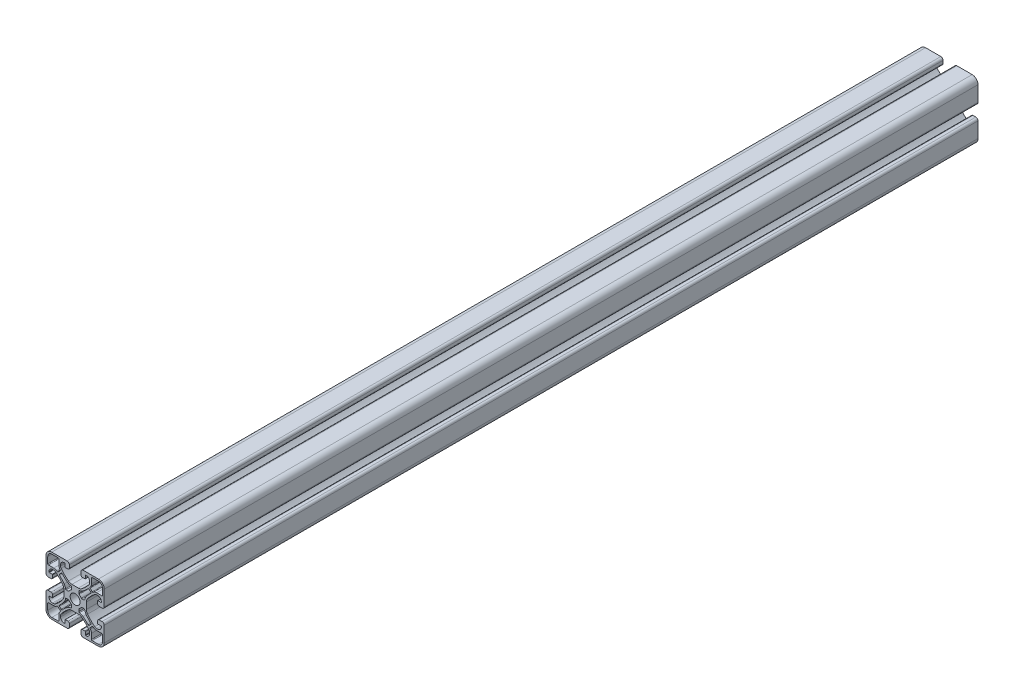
SolidWorks part; units mm, degrees
ref_plane "Face" through (0, 0, 0) normal (0, 0, 1) x (1, 0, 0)
ref_plane "Dessus" through (0, 0, 0) normal (0, 1, 0) x (1, 0, 0)
ref_plane "Droite" through (0, 0, 0) normal (1, 0, 0) x (0, 0, -1)
sketch "Esquisse profilé" plane through (0, 0, 0) normal (0, 0, 1) x (1, 0, 0)
  line L0 (11.6997, 18.8) -> (16, 18.8)
  line L1 (18.8, 16) -> (18.8, 11.7)
  line L2 (18.3, 11.2) -> (14.67, 11.2)
  line L3 (12.3957, 10.2874) -> (12.7389, 10.5517)
  line L4 (11.7339, 10.3275) -> (10.3272, 11.7342)
  line L5 (10.5513, 12.7393) -> (10.2871, 12.3961)
  line L6 (11.1997, 14.6704) -> (11.1997, 18.3)
  line L7 (-11.1997, 14.6699) -> (-11.1997, 18.3)
  line L8 (-10.5517, 12.7393) -> (-10.2874, 12.3961)
  line L9 (-11.7342, 10.3275) -> (-10.3275, 11.7342)
  line L10 (-12.3961, 10.2874) -> (-12.7393, 10.5517)
  line L11 (-18.3, 11.2) -> (-14.6704, 11.2)
  line L12 (-18.8, 16) -> (-18.8, 11.7)
  line L13 (-11.6997, 18.8) -> (-16, 18.8)
  line L14 (-2.5, 6.0982) -> (-2.5, 4.6098)
  line L15 (-4.6098, 2.5) -> (-6.0982, 2.5)
  line L16 (-10.7615, 9.6032) -> (-9.6032, 10.7615)
  line L17 (-10.7615, -9.6032) -> (-9.6032, -10.7615)
  line L18 (-4.6098, -2.5) -> (-6.0982, -2.5)
  line L19 (-2.5, -6.0982) -> (-2.5, -4.6098)
  line L20 (-11.7, -18.8) -> (-16, -18.8)
  line L21 (-18.8, -16) -> (-18.8, -11.7)
  line L22 (-18.3, -11.2) -> (-14.6704, -11.2)
  line L23 (-12.3961, -10.2874) -> (-12.7393, -10.5517)
  line L24 (-11.7342, -10.3275) -> (-10.3275, -11.7342)
  line L25 (-10.5517, -12.7393) -> (-10.2874, -12.3961)
  line L26 (-11.2, -14.6704) -> (-11.2, -18.3)
  line L27 (9.6032, 10.7615) -> (10.7615, 9.6032)
  line L28 (6.0982, 2.5) -> (4.6098, 2.5)
  line L29 (2.5, 4.6098) -> (2.5, 6.0982)
  line L30 (2.5, -4.6098) -> (2.5, -6.0982)
  line L31 (6.0982, -2.5) -> (4.6098, -2.5)
  line L32 (9.6032, -10.7615) -> (10.7615, -9.6032)
  line L33 (11.1997, -14.6704) -> (11.1997, -18.3)
  line L34 (10.5513, -12.7393) -> (10.2871, -12.3961)
  line L35 (11.7339, -10.3275) -> (10.3272, -11.7342)
  line L36 (12.3957, -10.2874) -> (12.7389, -10.5517)
  line L37 (18.3, -11.2) -> (14.67, -11.2)
  line L38 (18.8, -16) -> (18.8, -11.7)
  line L39 (11.6997, -18.8) -> (16, -18.8)
  line L40 (5.5, -20) -> (16, -20)
  line L41 (4, -16.5) -> (4, -18.5)
  line L42 (6.75, -15.5) -> (5, -15.5)
  line L43 (7, -17.75) -> (7, -15.75)
  line L44 (7.5, -18) -> (7.25, -18)
  line L45 (10, -14.7204) -> (10, -15.5)
  line L46 (-2.1931, -7.75) -> (2.1931, -7.75)
  line L47 (-10, -15.5) -> (-10, -14.7204)
  line L48 (-7.25, -18) -> (-7.5, -18)
  line L49 (-7, -15.75) -> (-7, -17.75)
  line L50 (-5, -15.5) -> (-6.75, -15.5)
  line L51 (-4, -18.5) -> (-4, -16.5)
  line L52 (-16, -20) -> (-5.5, -20)
  line L53 (-20, -5.5) -> (-20, -16)
  line L54 (-16.5, -4) -> (-18.5, -4)
  line L55 (-15.5, -6.75) -> (-15.5, -5)
  line L56 (-17.75, -7) -> (-15.75, -7)
  line L57 (-18, -7.5) -> (-18, -7.25)
  line L58 (-14.7204, -10) -> (-15.5, -10)
  line L59 (-7.75, 2.1931) -> (-7.75, -2.1931)
  line L60 (-15.5, 10) -> (-14.7204, 10)
  line L61 (-18, 7.25) -> (-18, 7.5)
  line L62 (-15.75, 7) -> (-17.75, 7)
  line L63 (-15.5, 5) -> (-15.5, 6.75)
  line L64 (-18.5, 4) -> (-16.5, 4)
  line L65 (-20, 16) -> (-20, 5.5)
  line L66 (-5.5, 20) -> (-16, 20)
  line L67 (-4, 16.5) -> (-4, 18.5)
  line L68 (-6.75, 15.5) -> (-5, 15.5)
  line L69 (-7, 17.75) -> (-7, 15.75)
  line L70 (-7.5, 18) -> (-7.25, 18)
  line L71 (-10, 14.7204) -> (-10, 15.5)
  line L72 (2.1931, 7.75) -> (-2.1931, 7.75)
  line L73 (10, 15.5) -> (10, 14.7204)
  line L74 (7.25, 18) -> (7.5, 18)
  line L75 (7, 15.75) -> (7, 17.75)
  line L76 (5, 15.5) -> (6.75, 15.5)
  line L77 (4, 18.5) -> (4, 16.5)
  line L78 (16, 20) -> (5.5, 20)
  line L79 (20, 5.5) -> (20, 16)
  line L80 (16.5, 4) -> (18.5, 4)
  line L81 (15.5, 6.75) -> (15.5, 5)
  line L82 (17.75, 7) -> (15.75, 7)
  line L83 (18, 7.5) -> (18, 7.25)
  line L84 (14.7204, 10) -> (15.5, 10)
  line L85 (7.75, -2.1931) -> (7.75, 2.1931)
  line L86 (15.5, -10) -> (14.7204, -10)
  line L87 (18, -7.25) -> (18, -7.5)
  line L88 (15.75, -7) -> (17.75, -7)
  line L89 (15.5, -5) -> (15.5, -6.75)
  line L90 (18.5, -4) -> (16.5, -4)
  line L91 (20, -16) -> (20, -5.5)
  arc A0 (11.1997, 18.3) -> (11.6997, 18.8) centre (11.6997, 18.3) cw
  arc A1 (-11.1997, 14.6699) -> (-10.5517, 12.7393) centre (-7.9997, 14.6699) ccw
  arc A2 (16, 18.8) -> (18.8, 16) centre (16, 16) cw
  arc A3 (18.8, 11.7) -> (18.3, 11.2) centre (18.3, 11.7) cw
  arc A4 (12.7389, 10.5517) -> (14.67, 11.2) centre (14.67, 8) cw
  arc A5 (12.3957, 10.2874) -> (11.7339, 10.3275) centre (12.0874, 10.6811) cw
  arc A6 (10.3272, 11.7342) -> (10.2871, 12.3961) centre (10.6807, 12.0878) cw
  arc A7 (11.1997, 14.6704) -> (10.5513, 12.7393) centre (7.9997, 14.6704) cw
  arc A8 (-10.3275, 11.7342) -> (-10.2874, 12.3961) centre (-10.6811, 12.0878) ccw
  arc A9 (-12.3961, 10.2874) -> (-11.7342, 10.3275) centre (-12.0878, 10.6811) ccw
  arc A10 (-12.7393, 10.5517) -> (-14.6704, 11.2) centre (-14.6704, 8) ccw
  arc A11 (-18.8, 11.7) -> (-18.3, 11.2) centre (-18.3, 11.7) ccw
  arc A12 (-16, 18.8) -> (-18.8, 16) centre (-16, 16) ccw
  arc A13 (-11.1997, 18.3) -> (-11.6997, 18.8) centre (-11.6997, 18.3) ccw
  arc A14 (-8.8828, 10.7477) -> (-5.38, 7.59) centre (10.34, 28.55) ccw
  arc A15 (-5.38, 7.59) -> (-2.9351, 6.594) centre (-2.26, 11.75) ccw
  arc A16 (-2.5, 6.0982) -> (-2.9351, 6.594) centre (-3, 6.0982) ccw
  arc A17 (-2.7273, 4.1907) -> (-2.5, 4.6098) centre (-3, 4.6098) ccw
  arc A18 (-2.7273, 4.1907) -> (-4.1907, 2.7273) centre (0, 0) ccw
  arc A19 (-4.6098, 2.5) -> (-4.1907, 2.7273) centre (-4.6098, 3) ccw
  arc A20 (-6.594, 2.9351) -> (-6.0982, 2.5) centre (-6.0982, 3) ccw
  arc A21 (-6.594, 2.9351) -> (-7.59, 5.38) centre (-11.75, 2.26) ccw
  arc A22 (-7.59, 5.38) -> (-10.7477, 8.8828) centre (-28.55, -10.34) ccw
  arc A23 (-10.7615, 9.6032) -> (-10.7477, 8.8828) centre (-10.4079, 9.2497) ccw
  arc A24 (-8.8828, 10.7477) -> (-9.6032, 10.7615) centre (-9.2497, 10.4079) ccw
  arc A25 (-8.8828, -10.7477) -> (-9.6032, -10.7615) centre (-9.2497, -10.4079) cw
  arc A26 (-10.7615, -9.6032) -> (-10.7477, -8.8828) centre (-10.4079, -9.2497) cw
  arc A27 (-7.59, -5.38) -> (-10.7477, -8.8828) centre (-28.55, 10.34) cw
  arc A28 (-6.594, -2.9351) -> (-7.59, -5.38) centre (-11.75, -2.26) cw
  arc A29 (-6.594, -2.9351) -> (-6.0982, -2.5) centre (-6.0982, -3) cw
  arc A30 (-4.6098, -2.5) -> (-4.1907, -2.7273) centre (-4.6098, -3) cw
  arc A31 (-2.7273, -4.1907) -> (-4.1907, -2.7273) centre (0, 0) cw
  arc A32 (-2.7273, -4.1907) -> (-2.5, -4.6098) centre (-3, -4.6098) cw
  arc A33 (-2.5, -6.0982) -> (-2.9351, -6.594) centre (-3, -6.0982) cw
  arc A34 (-5.38, -7.59) -> (-2.9351, -6.594) centre (-2.26, -11.75) cw
  arc A35 (-8.8828, -10.7477) -> (-5.38, -7.59) centre (10.34, -28.55) cw
  arc A36 (-11.2, -18.3) -> (-11.7, -18.8) centre (-11.7, -18.3) cw
  arc A37 (-16, -18.8) -> (-18.8, -16) centre (-16, -16) cw
  arc A38 (-18.8, -11.7) -> (-18.3, -11.2) centre (-18.3, -11.7) cw
  arc A39 (-12.7393, -10.5517) -> (-14.6704, -11.2) centre (-14.6704, -8) cw
  arc A40 (-12.3961, -10.2874) -> (-11.7342, -10.3275) centre (-12.0878, -10.6811) cw
  arc A41 (-10.3275, -11.7342) -> (-10.2874, -12.3961) centre (-10.6811, -12.0878) cw
  arc A42 (-11.2, -14.6704) -> (-10.5517, -12.7393) centre (-8, -14.6704) cw
  arc A43 (10.7477, 8.8828) -> (10.7615, 9.6032) centre (10.4079, 9.2497) ccw
  arc A44 (10.7477, 8.8828) -> (7.59, 5.38) centre (28.55, -10.34) ccw
  arc A45 (7.59, 5.38) -> (6.594, 2.9351) centre (11.75, 2.26) ccw
  arc A46 (6.0982, 2.5) -> (6.594, 2.9351) centre (6.0982, 3) ccw
  arc A47 (4.1907, 2.7273) -> (4.6098, 2.5) centre (4.6098, 3) ccw
  arc A48 (4.1907, 2.7273) -> (2.7273, 4.1907) centre (0, 0) ccw
  arc A49 (2.5, 4.6098) -> (2.7273, 4.1907) centre (3, 4.6098) ccw
  arc A50 (2.9351, 6.594) -> (2.5, 6.0982) centre (3, 6.0982) ccw
  arc A51 (2.9351, 6.594) -> (5.38, 7.59) centre (2.26, 11.75) ccw
  arc A52 (5.38, 7.59) -> (8.8828, 10.7477) centre (-10.34, 28.55) ccw
  arc A53 (9.6032, 10.7615) -> (8.8828, 10.7477) centre (9.2497, 10.4079) ccw
  arc A54 (9.6032, -10.7615) -> (8.8828, -10.7477) centre (9.2497, -10.4079) cw
  arc A55 (5.38, -7.59) -> (8.8828, -10.7477) centre (-10.34, -28.55) cw
  arc A56 (2.9351, -6.594) -> (5.38, -7.59) centre (2.26, -11.75) cw
  arc A57 (2.9351, -6.594) -> (2.5, -6.0982) centre (3, -6.0982) cw
  arc A58 (2.5, -4.6098) -> (2.7273, -4.1907) centre (3, -4.6098) cw
  arc A59 (4.1907, -2.7273) -> (2.7273, -4.1907) centre (0, 0) cw
  arc A60 (4.1907, -2.7273) -> (4.6098, -2.5) centre (4.6098, -3) cw
  arc A61 (6.0982, -2.5) -> (6.594, -2.9351) centre (6.0982, -3) cw
  arc A62 (7.59, -5.38) -> (6.594, -2.9351) centre (11.75, -2.26) cw
  arc A63 (10.7477, -8.8828) -> (7.59, -5.38) centre (28.55, 10.34) cw
  arc A64 (10.7477, -8.8828) -> (10.7615, -9.6032) centre (10.4079, -9.2497) cw
  arc A65 (11.1997, -14.6704) -> (10.5513, -12.7393) centre (7.9997, -14.6704) ccw
  arc A66 (10.3272, -11.7342) -> (10.2871, -12.3961) centre (10.6807, -12.0878) ccw
  arc A67 (12.3957, -10.2874) -> (11.7339, -10.3275) centre (12.0874, -10.6811) ccw
  arc A68 (12.7389, -10.5517) -> (14.67, -11.2) centre (14.67, -8) ccw
  arc A69 (18.8, -11.7) -> (18.3, -11.2) centre (18.3, -11.7) ccw
  arc A70 (16, -18.8) -> (18.8, -16) centre (16, -16) ccw
  arc A71 (11.1997, -18.3) -> (11.6997, -18.8) centre (11.6997, -18.3) ccw
  circle A72 centre (0, 0) radius 3.4
  arc A73 (16, -20) -> (20, -16) centre (16, -16) ccw
  arc A74 (4, -18.5) -> (5.5, -20) centre (5.5, -18.5) ccw
  arc A75 (5, -15.5) -> (4, -16.5) centre (5, -16.5) ccw
  arc A76 (7, -15.75) -> (6.75, -15.5) centre (6.75, -15.75) ccw
  arc A77 (7, -17.75) -> (7.25, -18) centre (7.25, -17.75) ccw
  arc A78 (7.5, -18) -> (10, -15.5) centre (7.5, -15.5) ccw
  arc A79 (10, -14.7204) -> (9.5948, -13.5134) centre (8, -14.7204) ccw
  arc A80 (9.5948, -13.5134) -> (4.5803, -8.5405) centre (-10.34, -28.6) ccw
  arc A81 (4.5803, -8.5405) -> (2.1931, -7.75) centre (2.1931, -11.75) ccw
  arc A82 (-2.1931, -7.75) -> (-4.5803, -8.5405) centre (-2.1931, -11.75) ccw
  arc A83 (-4.5803, -8.5405) -> (-9.5948, -13.5134) centre (10.34, -28.6) ccw
  arc A84 (-9.5948, -13.5134) -> (-10, -14.7204) centre (-8, -14.7204) ccw
  arc A85 (-10, -15.5) -> (-7.5, -18) centre (-7.5, -15.5) ccw
  arc A86 (-7.25, -18) -> (-7, -17.75) centre (-7.25, -17.75) ccw
  arc A87 (-6.75, -15.5) -> (-7, -15.75) centre (-6.75, -15.75) ccw
  arc A88 (-4, -16.5) -> (-5, -15.5) centre (-5, -16.5) ccw
  arc A89 (-5.5, -20) -> (-4, -18.5) centre (-5.5, -18.5) ccw
  arc A90 (-20, -16) -> (-16, -20) centre (-16, -16) ccw
  arc A91 (-18.5, -4) -> (-20, -5.5) centre (-18.5, -5.5) ccw
  arc A92 (-15.5, -5) -> (-16.5, -4) centre (-16.5, -5) ccw
  arc A93 (-15.75, -7) -> (-15.5, -6.75) centre (-15.75, -6.75) ccw
  arc A94 (-17.75, -7) -> (-18, -7.25) centre (-17.75, -7.25) ccw
  arc A95 (-18, -7.5) -> (-15.5, -10) centre (-15.5, -7.5) ccw
  arc A96 (-14.7204, -10) -> (-13.5134, -9.5948) centre (-14.7204, -8) ccw
  arc A97 (-13.5134, -9.5948) -> (-8.5405, -4.5803) centre (-28.6, 10.34) ccw
  arc A98 (-8.5405, -4.5803) -> (-7.75, -2.1931) centre (-11.75, -2.1931) ccw
  arc A99 (-7.75, 2.1931) -> (-8.5405, 4.5803) centre (-11.75, 2.1931) ccw
  arc A100 (-8.5405, 4.5803) -> (-13.5134, 9.5948) centre (-28.6, -10.34) ccw
  arc A101 (-13.5134, 9.5948) -> (-14.7204, 10) centre (-14.7204, 8) ccw
  arc A102 (-15.5, 10) -> (-18, 7.5) centre (-15.5, 7.5) ccw
  arc A103 (-18, 7.25) -> (-17.75, 7) centre (-17.75, 7.25) ccw
  arc A104 (-15.5, 6.75) -> (-15.75, 7) centre (-15.75, 6.75) ccw
  arc A105 (-16.5, 4) -> (-15.5, 5) centre (-16.5, 5) ccw
  arc A106 (-20, 5.5) -> (-18.5, 4) centre (-18.5, 5.5) ccw
  arc A107 (-16, 20) -> (-20, 16) centre (-16, 16) ccw
  arc A108 (-4, 18.5) -> (-5.5, 20) centre (-5.5, 18.5) ccw
  arc A109 (-5, 15.5) -> (-4, 16.5) centre (-5, 16.5) ccw
  arc A110 (-7, 15.75) -> (-6.75, 15.5) centre (-6.75, 15.75) ccw
  arc A111 (-7, 17.75) -> (-7.25, 18) centre (-7.25, 17.75) ccw
  arc A112 (-7.5, 18) -> (-10, 15.5) centre (-7.5, 15.5) ccw
  arc A113 (-10, 14.7204) -> (-9.5948, 13.5134) centre (-8, 14.7204) ccw
  arc A114 (-9.5948, 13.5134) -> (-4.5803, 8.5405) centre (10.34, 28.6) ccw
  arc A115 (-4.5803, 8.5405) -> (-2.1931, 7.75) centre (-2.1931, 11.75) ccw
  arc A116 (2.1931, 7.75) -> (4.5803, 8.5405) centre (2.1931, 11.75) ccw
  arc A117 (4.5803, 8.5405) -> (9.5948, 13.5134) centre (-10.34, 28.6) ccw
  arc A118 (9.5948, 13.5134) -> (10, 14.7204) centre (8, 14.7204) ccw
  arc A119 (10, 15.5) -> (7.5, 18) centre (7.5, 15.5) ccw
  arc A120 (7.25, 18) -> (7, 17.75) centre (7.25, 17.75) ccw
  arc A121 (6.75, 15.5) -> (7, 15.75) centre (6.75, 15.75) ccw
  arc A122 (4, 16.5) -> (5, 15.5) centre (5, 16.5) ccw
  arc A123 (5.5, 20) -> (4, 18.5) centre (5.5, 18.5) ccw
  arc A124 (20, 16) -> (16, 20) centre (16, 16) ccw
  arc A125 (18.5, 4) -> (20, 5.5) centre (18.5, 5.5) ccw
  arc A126 (15.5, 5) -> (16.5, 4) centre (16.5, 5) ccw
  arc A127 (15.75, 7) -> (15.5, 6.75) centre (15.75, 6.75) ccw
  arc A128 (17.75, 7) -> (18, 7.25) centre (17.75, 7.25) ccw
  arc A129 (18, 7.5) -> (15.5, 10) centre (15.5, 7.5) ccw
  arc A130 (14.7204, 10) -> (13.5134, 9.5948) centre (14.7204, 8) ccw
  arc A131 (13.5134, 9.5948) -> (8.5405, 4.5803) centre (28.6, -10.34) ccw
  arc A132 (8.5405, 4.5803) -> (7.75, 2.1931) centre (11.75, 2.1931) ccw
  arc A133 (7.75, -2.1931) -> (8.5405, -4.5803) centre (11.75, -2.1931) ccw
  arc A134 (8.5405, -4.5803) -> (13.5134, -9.5948) centre (28.6, 10.34) ccw
  arc A135 (13.5134, -9.5948) -> (14.7204, -10) centre (14.7204, -8) ccw
  arc A136 (15.5, -10) -> (18, -7.5) centre (15.5, -7.5) ccw
  arc A137 (18, -7.25) -> (17.75, -7) centre (17.75, -7.25) ccw
  arc A138 (15.5, -6.75) -> (15.75, -7) centre (15.75, -6.75) ccw
  arc A139 (16.5, -4) -> (15.5, -5) centre (16.5, -5) ccw
  arc A140 (20, -5.5) -> (18.5, -4) centre (18.5, -5.5) ccw
extrude "Extrusion1" add sketch "Esquisse profilé" along normal blind 600
